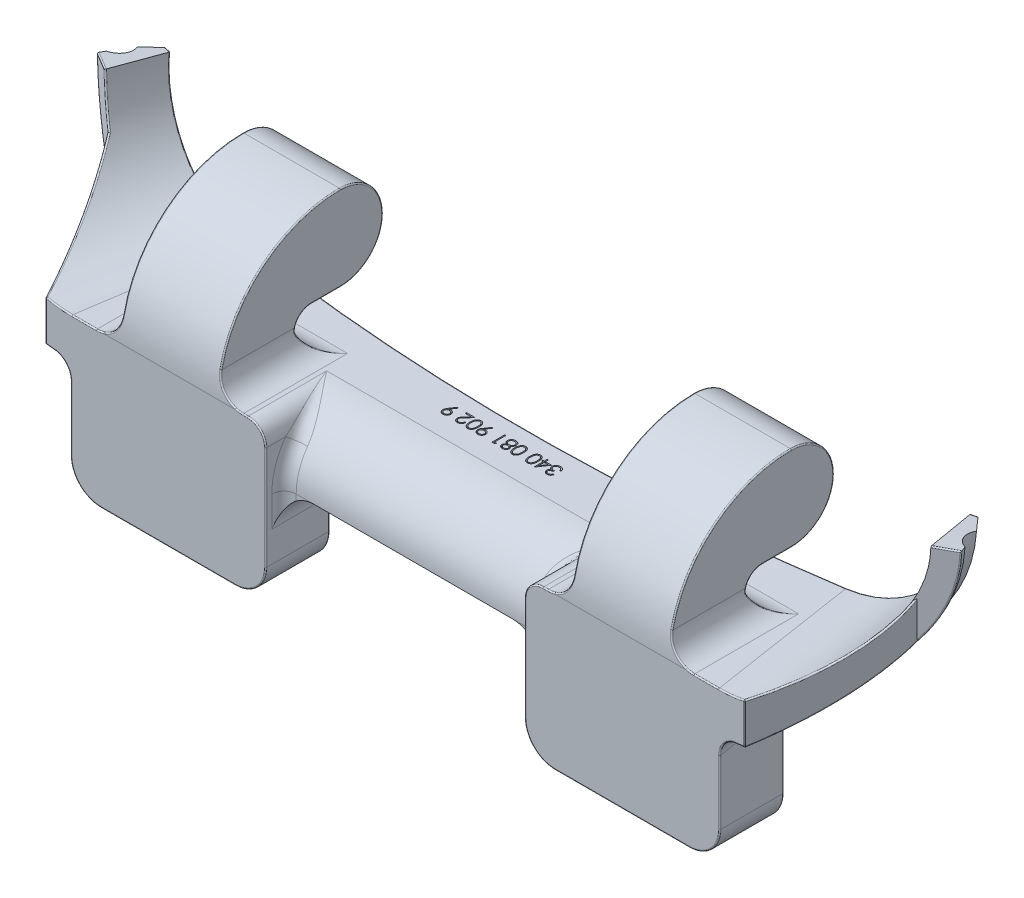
SolidWorks part; units mm, degrees
ref_plane "Plan de face" through (0, 0, 0) normal (0, 0, 1) x (1, 0, 0)
ref_plane "Plan de dessus" through (0, 0, 0) normal (0, 1, 0) x (1, 0, 0)
ref_plane "Plan de droite" through (0, 0, 0) normal (1, 0, 0) x (0, 0, -1)
ref_plane "Plan1" through (0, 0, 9.5) normal (0, 0, 1) x (1, 0, 0)
sketch "Esquisse1" plane through (0, 0, 9.5) normal (0, 0, 1) x (1, 0, 0)
  line L0 (-21.25, -37.5) -> (-21.25, -22.5)
  line L1 (-53.25, -12.5) -> (53.25, -12.5)
  line L2 (-53.25, -12.5) -> (-53.25, -37.5)
  line L3 (-53.25, -37.5) -> (-21.25, -37.5)
  line L4 (53.25, -12.5) -> (53.25, -37.5)
  line L5 (-21.25, -22.5) -> (21.25, -22.5)
  line L6 (21.25, -22.5) -> (21.25, -37.5)
  line L7 (21.25, -37.5) -> (53.25, -37.5)
  dimension "D1" = 106.5
  dimension "D2" = 53.25
  dimension "D3" = 12.5
  dimension "D4" = 25
  dimension "D5" = 15
  dimension "D6" = 32
  dimension "D7" = 32
extrude "Extrusion1" add sketch "Esquisse1" along normal blind 10.5
fillet "Congé1" radius 5 6 edges at (-53.25, -37.5, 14.75) (-21.25, -37.5, 14.75) (-21.25, -22.5, 14.75) (21.25, -22.5, 14.75) (21.25, -37.5, 14.75) (53.25, -37.5, 14.75)
ref_plane "Plan2" through (29, 0, 0) normal (1, 0, 0) x (0, 0, -1)
ref_plane "Plan3" through (-29, 0, 0) normal (1, 0, 0) x (0, 0, -1)
sketch "Esquisse2" plane through (29, 0, 0) normal (1, 0, 0) x (0, 0, -1)
  line L4 (-20, -32.5) -> (-20, -12.5) construction
  line L5 (-20, -12.5) -> (-9.5, -12.5) construction
  line L7 (-7.5, -6.5) -> (0, -6.5)
  line L8 (-20, -12.5) -> (-7.5, -12.5)
  line L10 (-7.5, -6.5) -> (-7.5, -12.5)
  arc A0 (0, 7.5) -> (-20, -12.5) centre (0, -12.5) ccw
  arc A1 (0, 7.5) -> (0, -6.5) centre (0, 0.5) cw
  dimension "D1" = 7
sketch "Esquisse3" plane through (-29, 0, 0) normal (1, 0, 0) x (0, 0, -1)
  line L0 (-7.5, -6.5) -> (0, -6.5) construction
  line L1 (-7.5, -6.5) -> (-7.5, -12.5) construction
  line L2 (-20, -12.5) -> (-7.5, -12.5) construction
  line L3 (-7.5, -6.5) -> (0, -6.5)
  line L4 (-7.5, -6.5) -> (-7.5, -12.5)
  line L5 (-20, -12.5) -> (-7.5, -12.5)
  arc A0 (0, -6.5) -> (0, 7.5) centre (0, 0.5) ccw construction
  arc A1 (0, 7.5) -> (-20, -12.5) centre (0, -12.5) ccw construction
  arc A2 (0, -6.5) -> (0, 7.5) centre (0, 0.5) ccw
  arc A3 (0, 7.5) -> (-20, -12.5) centre (0, -12.5) ccw
extrude "Extrusion2" add sketch "Esquisse2" along normal blind 16
extrude "Extrusion3" add sketch "Esquisse3" against normal blind 16
fillet "Congé2" radius 2.75 2 edges at (-37, -6.5, 7.5) (37, -6.5, 7.5)
sketch "Esquisse8" plane through (0, -12.5, 0) normal (0, 1, 0) x (-1, 0, 0)
  line L0 (-21.25, 20) -> (-21.25, 9.5) construction
  line L1 (-21.25, 17) -> (21.25, 17)
  line L2 (-21.25, 17) -> (-21.25, 20)
  line L3 (-21.25, 20) -> (21.25, 20)
  line L4 (21.25, 17) -> (21.25, 20)
  dimension "D1" = 3
extrude "Enlèv. mat.-Extru.2" cut sketch "Esquisse8" against normal through all
sketch "Esquisse9" plane through (0, 0, 0) normal (1, 0, 0) x (0, 0, -1)
  line L2 (1, -12.5) -> (1, -13.5)
  line L4 (-14, -17.25) -> (-5.6842, -15.7837)
  line L5 (1, -12.5) -> (-14, -12.5)
  line L7 (-20, -12.5) -> (-9.5, -12.5) construction
  line L9 (-14, -12.5) -> (-14, -17.25)
  line L10 (-7.5, -12.5) -> (-7.5, -9.25) construction
  line L13 (-9.5, 24.475) -> (-9.5, -24.475) construction
  line L14 (-1.9264, -15.0574) -> (1, -13.5)
  arc A0 (-1.9264, -15.0574) -> (-5.6842, -15.7837) centre (-3.5, -17) ccw
  dimension "D4" = 1
  dimension "D5" = 4.75
  dimension "D6" = 5
  dimension "D1" = 8.5
  dimension "D2" = 80
  dimension "D3" = 15
  dimension "D7" = 6
sketch "Esquisse19" plane through (0, 0, 0) normal (0, 1, 0) x (1, 0, 0)
  arc A0 (-49.25, 4.8587) -> (49.25, 4.8587) centre (0, 324.8315) ccw
sweep "Balayage12" add profiles "Esquisse9" path "Esquisse19"
mirror "Symétrie11" about plane through (0, 0, 0) normal (1, 0, 0) of "Balayage12"
sketch "Esquisse28" plane through (-48.8408, 0, -7.5175) normal (-0.9884, 0, -0.1521) x (-0.1521, 0, 0.9884)
  line L1 (30.4009, -19.4753) -> (30.4009, -12.5)
  line L3 (27.094, 6.5) -> (-5.4101, 3.6563) construction
  line L5 (17.2179, -17.1508) -> (17.2179, -12.5)
  line L6 (17.2179, -12.5) -> (2.7808, -12.5)
  line L7 (2.7808, -12.5) -> (2.7808, -13.5)
  line L8 (2.7808, -13.5) -> (5.7071, -15.0574)
  line L9 (9.4649, -15.7837) -> (17.2179, -17.1508)
  line L11 (30.4009, -12.5) -> (2.7808, -12.5)
  line L12 (2.7808, -12.5) -> (2.7808, -13.5)
  line L13 (2.7808, -13.5) -> (5.7071, -15.0574)
  line L14 (9.4649, -15.7837) -> (30.4009, -19.4753)
  arc A1 (9.4649, -15.7837) -> (5.7071, -15.0574) centre (7.2808, -17) ccw
  arc A2 (9.4649, -15.7837) -> (5.7071, -15.0574) centre (7.2808, -17) ccw
  dimension "D2" = 19
  dimension "D3" = 5
  dimension "D1" = 0
revolve "Révolution3" add sketch "Esquisse28" angle 90 about L3
sketch "Esquisse40" plane through (0, -37.5, 0) normal (0, -1, 0) x (1, 0, 0)
  line L0 (-55.9789, 22.8974) -> (-84.4188, 19.3154)
  line L1 (-84.4188, 19.3154) -> (-73.4346, -3.5534)
  line L3 (-55.9789, 22.8974) -> (-66.3893, 0.7424)
  line L4 (-66.3893, 0.7424) -> (-73.4346, -3.5534)
extrude "Enlèv. mat.-Extru.6" cut sketch "Esquisse40" against normal through all
sketch "Esquisse42" plane through (0, -37.5, 0) normal (0, -1, 0) x (1, 0, 0)
  line L0 (-48.25, 20) -> (-53.25, 20) construction
  line L1 (-48.25, 20) -> (-58.8272, 20)
  line L2 (-48.25, 20) -> (-48.25, 24.3099)
  line L3 (-48.25, 24.3099) -> (-58.8272, 24.3099)
  line L4 (-58.8272, 20) -> (-58.8272, 24.3099)
extrude "Enlèv. mat.-Extru.7" cut sketch "Esquisse42" against normal through all
mirror "Symétrie13" about plane through (0, 0, 0) normal (1, 0, 0) of "Enlèv. mat.-Extru.7", "Enlèv. mat.-Extru.6", "Révolution3"
fillet "Congé9" radius 3 2 edges
fillet "Congé10" radius 2 3 edges at (-53.632, -17.1096, 9.5) (53.632, -17.1096, 9.5)
fillet "Congé11" radius 5 2 edges at (37, -12.5, 7.5) (-37, -12.5, 7.5)
fillet "Congé12" radius 4 4 edges at (-29, -12.5, 11.4081) (-45, -12.5, 11.4081)
fillet "Congé15" radius 3 2 edges at (-21.25, -12.5, 18.5) (21.25, -12.5, 18.5)
fillet "Congé16" radius 10 1 edges at (0, -12.5, 17)
fillet "Congé17" radius 2 6 edges at (21.5297, -14.2352, 12.6296) (-21.5297, -14.2352, 12.6296) (-21.25, -18.7194, 16.2578) (-21.25, -25, 17) (21.25, -18.7194, 16.2578) (21.25, -25, 17)
fillet "Congé18" radius 0.2 86 edges at (29, -7.0563, 6.4083) (-45, -7.0563, 6.4083) (29, -6.5, 2.375) (-45, -6.5, 2.375) (29, 0.5, -7) (-45, 0.5, -7) (-45, 2.9919, 12.6491) (28.141, -10.9768, 19.9419) (-45.859, -10.9768, 19.9419) (-60.9457, -7.5956, -7.0013) (0, -12.5, -1) (61.638, -8.3049, -7.1336) (-61.638, -8.3049, -7.1336) (-54.4711, -17.3189, 8.9579) (-53.25, -26.1991, 9.5) (-51.7855, -36.0355, 9.5) (-37.25, -37.5, 9.5) (-22.7145, -36.0355, 9.5) (-21.25, -30, 9.5) (-19.7855, -23.9645, 9.5) (0, -22.5, 9.5) (19.7855, -23.9645, 9.5) (21.25, -30, 9.5) (22.7145, -36.0355, 9.5) (37.25, -37.5, 9.5) (51.7855, -36.0355, 9.5) (53.25, -26.1991, 9.5) (53.2601, -19.6468, 9.5) (22.1287, -13.3787, 20) (21.25, -24, 20) (22.7145, -36.0355, 20) (37.25, -37.5, 20) (51.7855, -36.0355, 20) (53.25, -27.2433, 20) (53.9286, -20.0514, 20) (45, -7.0563, 6.4083) (55.2198, -12.3821, 20) (46.502, -11.6241, 19.9808) (45, 0.5, -7) (-29, -7.0563, 6.4083) (-56.6738, -18.8775, 20) (-54.213, -19.7436, 20) (-53.25, -27.2433, 20) (-51.7855, -36.0355, 20) (-37.25, -37.5, 20) (-22.7145, -36.0355, 20) (-21.25, -24, 20) (-22.1287, -13.3787, 20) (-27.498, -11.6241, 19.9808) (-29, 2.9919, 12.6491) (-29, 0.5, -7) (-66.1396, 4.2409, -8.8928) (66.1396, 4.2409, -8.8928) (60.9457, -7.5956, -7.0013) (0, -13.5, -1) (54.4711, -17.3189, 8.9579) (62.8179, -8.4866, 8.3428) (69.3409, 4.961, -1.0573) (69.6728, -2.3672, -1.2597) (62.5077, -14.6264, 9.003) (-62.5077, -14.6264, 9.003) (-69.6728, -2.3672, -1.2597) (-69.3409, 4.961, -1.0573) (-67.4151, 1.3909, 0.1169) (-62.8179, -8.4866, 8.3428) (27.5881, -11.5499, 5.7485) (56.6738, -18.8775, 20) (57.3403, -15.4133, 20) (45, -6.5, 2.375) (46.4119, -11.5499, 5.7485) (-46.4119, -11.5499, 5.7485) (-55.2198, -12.3821, 20) (-57.3403, -15.4133, 20) (-29, -6.5, 2.375) (-27.5881, -11.5499, 5.7485)
sketch "Esquisse43" plane through (0, -12.5, 0) normal (0, 1, 0) x (-1, 0, 0)
  text T0 "340 081 902 9" font "Century Gothic" height in points 8
extrude "Enlèv. mat.-Extru.8" cut sketch "Esquisse43" against normal blind 0.5
